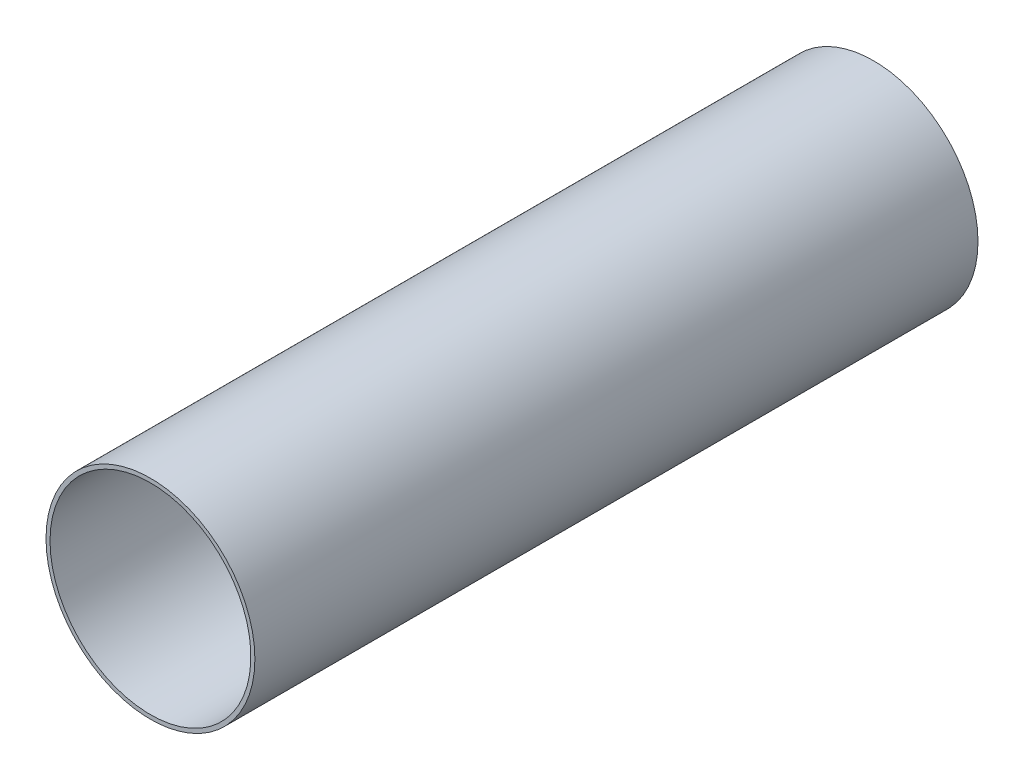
SolidWorks part; units mm, degrees
ref_plane "Plano frontal" through (0, 0, 0) normal (0, 0, 1) x (1, 0, 0)
ref_plane "Plano superior" through (0, 0, 0) normal (0, 1, 0) x (1, 0, 0)
ref_plane "Plano direito" through (0, 0, 0) normal (1, 0, 0) x (0, 0, -1)
sketch "Esboço1" plane through (0, 0, 0) normal (0, 0, 1) x (1, 0, 0)
  circle A0 centre (0, 0) radius 26
  circle A1 centre (0, 0) radius 25
surface "Superfície-Extrusão1" sketch "Esboço1" parameters "D1"=90, "D2"=90
